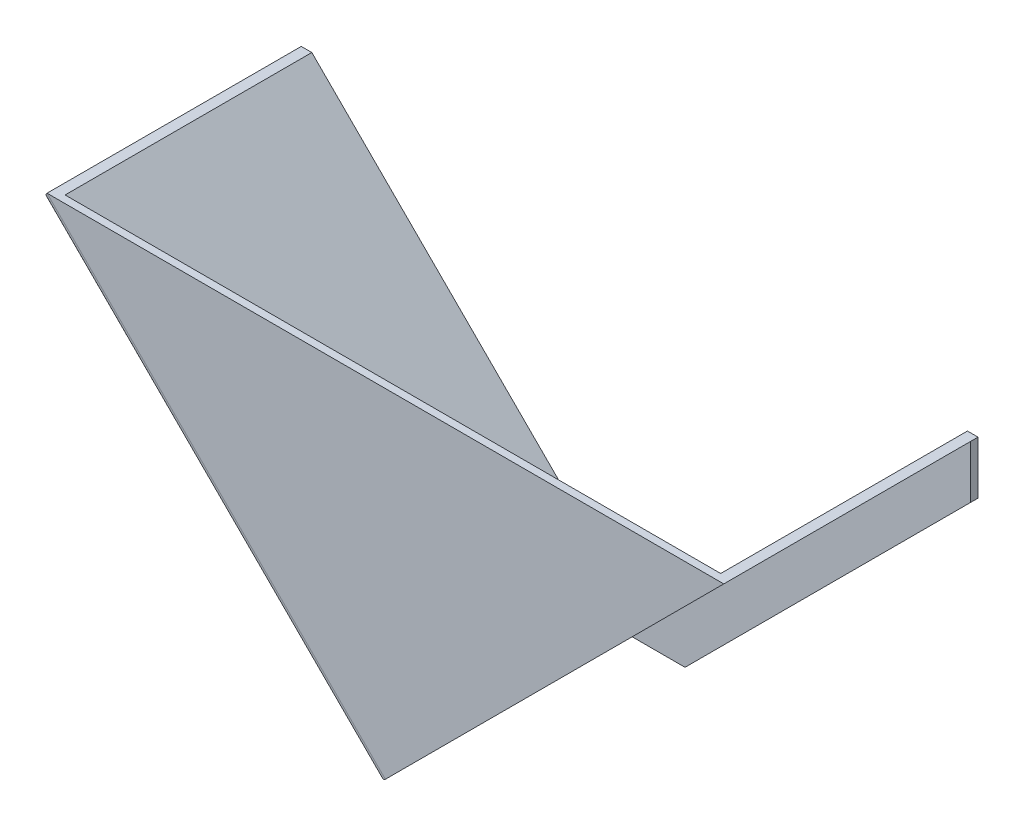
SolidWorks part; units mm, degrees
ref_plane "Front Plane" through (0, 0, 0) normal (0, 0, 1) x (1, 0, 0)
ref_plane "Top Plane" through (0, 0, 0) normal (0, 1, 0) x (1, 0, 0)
ref_plane "Right Plane" through (0, 0, 0) normal (1, 0, 0) x (0, 0, -1)
sketch "Sketch1" plane through (0, 0, 0) normal (0, 0, 1) x (1, 0, 0)
  line L0 (0, 0) -> (45.2548, 45.2548)
  line L1 (45.2548, 45.2548) -> (-45.2548, 45.2548)
  line L2 (-45.2548, 45.2548) -> (0, 0)
  line L3 (0, 0) -> (0, 45.2548) construction
  dimension "D1" = 64
  dimension "D2" = 45
extrude "Extrude1" add sketch "Sketch1" along normal blind 1
sketch "Sketch3" plane through (0, 0, 0) normal (-0.7071, -0.7071, 0) x (0, 0, 1)
  line L0 (1, 64) -> (-5, 58)
  line L1 (-5, 58) -> (-5, 6)
  line L2 (-5, 6) -> (1, 0)
  line L3 (1, 64) -> (1, 0)
  dimension "D1" = 6
  dimension "D2" = 45
  dimension "D3" = 45
extrude "Extrude3" add sketch "Sketch3" along normal blind 1
sketch "Sketch4" plane through (0, 0, 0) normal (0, 0, -1) x (-1, 0, 0)
  line L0 (43.8406, 45.2548) -> (45.2548, 45.2548)
  line L2 (45.2548, 45.2548) -> (0, 0)
  line L3 (0, 0) -> (-45.2548, 45.2548)
  line L4 (-45.2548, 45.2548) -> (-43.8406, 45.2548)
  line L5 (43.8406, 45.2548) -> (0, 1.4142)
  line L6 (0, 1.4142) -> (-43.8406, 45.2548)
  line L7 (44.5477, 45.9619) -> (0, 1.4142) construction
  line L8 (0, 1.4142) -> (-44.5477, 45.9619) construction
  dimension "D1" = 1
extrude "Extrude4" add sketch "Sketch4" along normal blind 32
sketch "Sketch5" plane through (0, 0, -32) normal (0, 0, -1) x (-1, 0, 0)
  line L0 (43.8406, 45.2548) -> (45.2548, 45.2548)
  line L1 (45.2548, 45.2548) -> (45.2548, 38.1838)
  line L2 (45.2548, 38.1838) -> (7.0711, 0)
  line L3 (7.0711, 0) -> (0, 0)
  line L4 (0, 0) -> (-7.0711, 0)
  line L5 (-7.0711, 0) -> (-45.2548, 38.1838)
  line L6 (-45.2548, 38.1838) -> (-45.2548, 45.2548)
  line L7 (-45.2548, 45.2548) -> (-43.8406, 45.2548)
  line L8 (-43.8406, 45.2548) -> (0, 1.4142)
  line L9 (0, 1.4142) -> (43.8406, 45.2548)
  line L10 (-45.2548, 45.2548) -> (0, 0) construction
  line L11 (0, 0) -> (45.2548, 45.2548) construction
  dimension "D1" = 6
  dimension "D2" = 6
  dimension "D3" = 45
  dimension "D4" = 45
  dimension "D5" = 45
  dimension "D6" = 45
extrude "Extrude5" add sketch "Sketch5" along normal blind 1
fillet "Fillet1" radius 1 2 edges at (-23.3345, 21.9203, 1) (-22.6274, 22.6274, -32)
